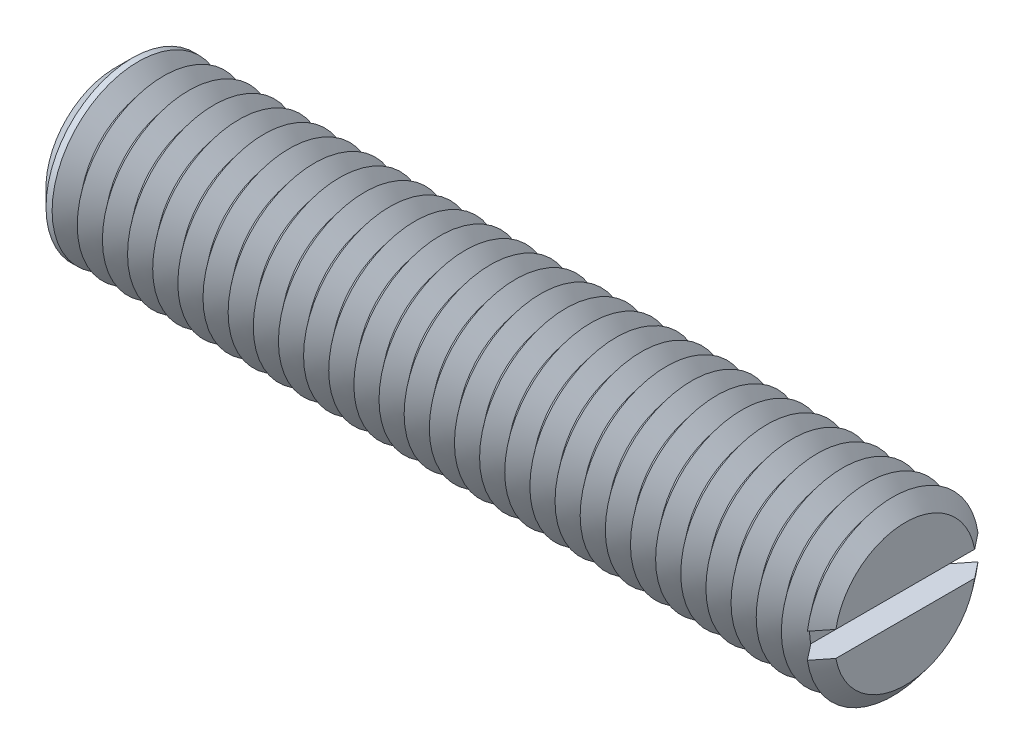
SolidWorks part; units mm, degrees
ref_plane "Front Plane" through (0, 0, 0) normal (0, 0, 1) x (1, 0, 0)
ref_plane "Top Plane" through (0, 0, 0) normal (0, 1, 0) x (1, 0, 0)
ref_plane "Right Plane" through (0, 0, 0) normal (1, 0, 0) x (0, 0, -1)
sketch "Sketch1" plane through (0, 0, 0) normal (1, 0, 0) x (0, 0, -1)
  circle A0 centre (0, 0) radius 6
  dimension "D1" = 12
extrude "Extrude1" add sketch "Sketch1" along normal mid plane 55
sketch "Sketch2" plane through (0, 0, 0) normal (0, 0, 1) x (1, 0, 0)
  line L0 (27.5, 0.875) -> (25.75, 0.875)
  line L1 (27.5, -6) -> (27.5, 6) construction
  line L2 (25.75, 0.875) -> (25.75, -0.875)
  line L3 (0, 0) -> (50000, 0) construction
  line L4 (27.5, -0.875) -> (25.75, -0.875)
  line L5 (27.5, -0.875) -> (27.5, 0.875)
  point P9 (25.75, 0)
  dimension "D1" = 1.75
extrude "Extrude2" cut sketch "Sketch2" against normal mid plane 18
chamfer "Chamfer1" distance 1.2 angle 45 1 edges at (-27.5, 0, -6)
sketch "Sketch3" plane through (0, 0, 0) normal (0, 0, 1) x (1, 0, 0)
  line L0 (0, 0) -> (30.9602, 0) construction
  line L1 (26.625, -6) -> (28.375, -6)
  line L2 (-26.3, -6) -> (27.5, -6) construction
  line L3 (28.375, -6) -> (27.5, -4.9071)
  line L4 (27.5, -6) -> (27.5, -0.875) construction
  line L5 (27.5, -4.9071) -> (26.625, -6)
  dimension "D1" = 1.75
  dimension "D2" = 1.4
revolve "Cut-Revolve1" cut sketch "Sketch3" angle 360 about L0
pattern_linear "LPattern1" count 31 spacing 1.75 along (-1, 0, 0) of "Cut-Revolve1"
equation "\"D2@Sketch3\" = \"D1@Sketch3\"*0.8"
